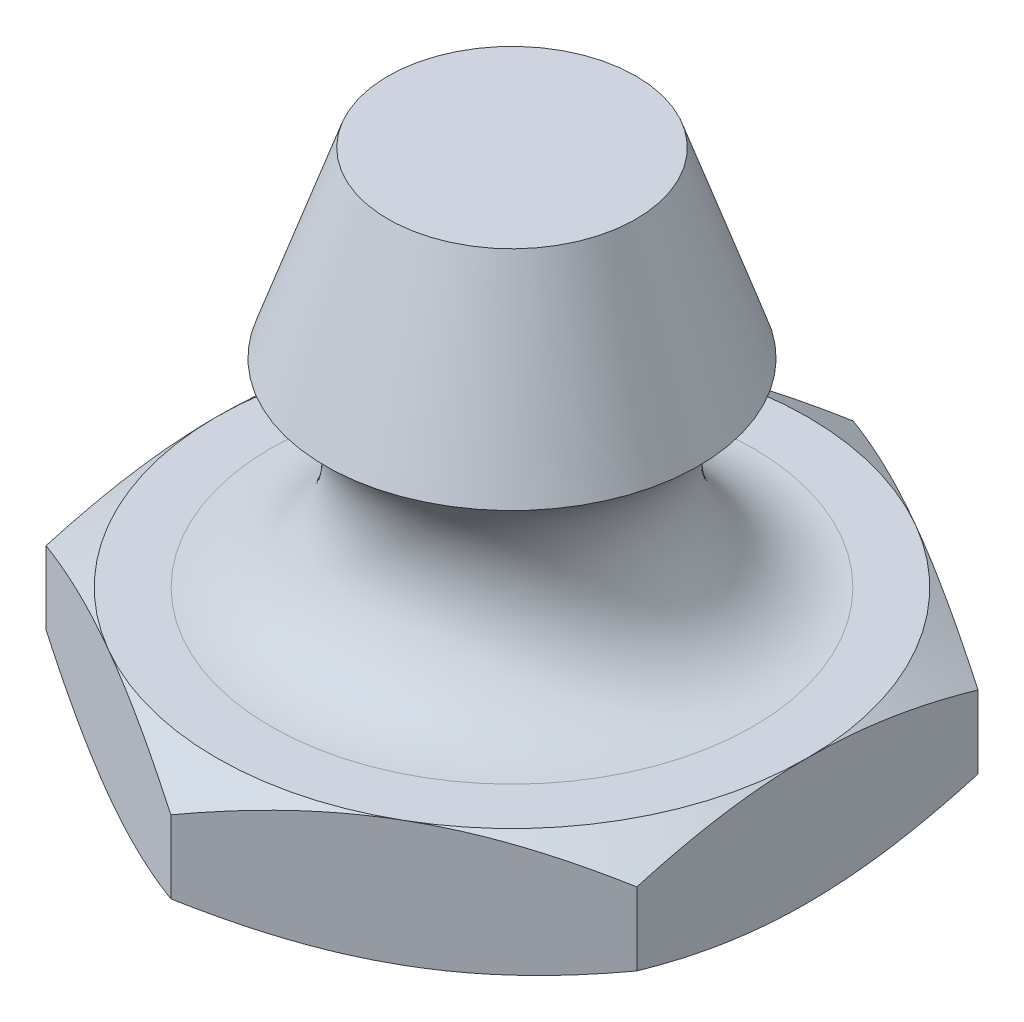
SolidWorks part; units mm, degrees
ref_plane "Front" through (0, 0, 0) normal (0, 0, 1) x (1, 0, 0)
ref_plane "Top" through (0, 0, 0) normal (0, 1, 0) x (1, 0, 0)
ref_plane "Right" through (0, 0, 0) normal (1, 0, 0) x (0, 0, -1)
sketch "Sketch1" plane through (0, 0, 0) normal (0, 1, 0) x (1, 0, 0)
  line L1 (-5.5563, 3.2079) -> (-5.5563, -3.2079)
  line L2 (-5.5563, -3.2079) -> (0, -6.4158)
  line L3 (0, -6.4158) -> (5.5562, -3.2079)
  line L4 (5.5562, -3.2079) -> (5.5562, 3.2079)
  line L5 (5.5562, 3.2079) -> (0, 6.4158)
  line L6 (0, 6.4158) -> (-5.5563, 3.2079)
  circle A0 centre (0, 0) radius 5.5563 construction
  dimension "HEX" = 11.1125
extrude "Base-Extrude" add sketch "Sketch1" along normal blind 9.525
sketch "Sketch2" plane through (0, 0, 0) normal (0, 0, 1) x (1, 0, 0)
  line L0 (0, 0.6975) -> (0, 10.1765) construction
  line L1 (-2.3318, 9.525) -> (-3.5125, 6.096)
  line L2 (-5.5563, 9.525) -> (0, 9.525) construction
  line L3 (-4.5339, 2.3622) -> (-9.4946, 2.3622)
  line L5 (-9.4946, 9.525) -> (-2.3318, 9.525)
  line L6 (-9.4946, 9.525) -> (-9.4946, 2.3622)
  line L7 (9.4946, 9.525) -> (9.4946, 2.3622) construction
  line L8 (9.4946, 9.525) -> (2.3318, 9.525) construction
  line L9 (4.5339, 2.3622) -> (9.4946, 2.3622) construction
  line L10 (2.3318, 9.525) -> (3.5125, 6.096) construction
  arc A0 (-3.5125, 6.096) -> (-4.5339, 2.3622) centre (-4.5339, 4.3688) cw
  arc A1 (3.5125, 6.096) -> (4.5339, 2.3622) centre (4.5339, 4.3688) ccw construction
  dimension "R" = 2.0066
  dimension "L1" = 3.429
  dimension "L2" = 3.7338
  dimension "D4" = 38
  dimension "DIA" = 5.0546
revolve "Cut-Revolve2" cut sketch "Sketch2" angle 360 about L0
sketch "Sketch4" plane through (0, 0, 0) normal (0, 0, 1) x (1, 0, 0)
  line L0 (0, 4.7396) -> (0, -1.8272) construction
  line L1 (-5.5563, 2.3622) -> (-7.9185, 2.3622)
  line L2 (-7.9185, 2.3622) -> (-7.9185, 0)
  line L3 (-7.602, 1.1811) -> (-5.5563, 2.3622)
  line L4 (-5.5563, 2.3622) -> (0, 2.3622) construction
  line L5 (-5.5563, 2.3622) -> (-5.5563, 0) construction
  line L6 (-5.5563, 0) -> (-7.9185, 0)
  line L7 (-5.5563, 0) -> (-7.602, 1.1811)
  dimension "D1" = 30
  dimension "D2" = 30
revolve "Cut-Revolve3" cut sketch "Sketch4" angle 360 about L0
